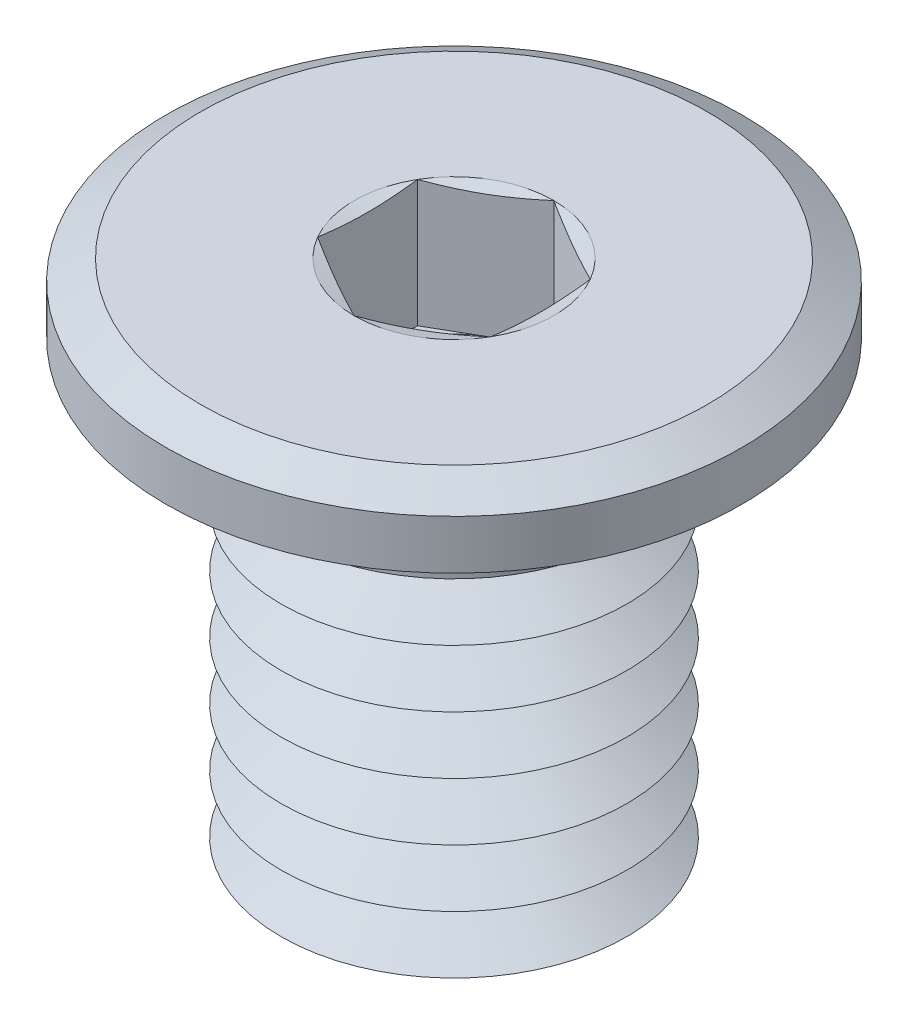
SolidWorks part; units mm, degrees
ref_plane "Front Plane" through (0, 0, 0) normal (0, 0, 1) x (1, 0, 0)
ref_plane "Top Plane" through (0, 0, 0) normal (0, 1, 0) x (1, 0, 0)
ref_plane "Right Plane" through (0, 0, 0) normal (1, 0, 0) x (0, 0, -1)
sketch "Sketch1" plane through (0, 0, 0) normal (0, 1, 0) x (1, 0, 0)
  circle A0 centre (0, 0) radius 5
  dimension "D1" = 10
extrude "Boss-Extrude1" add sketch "Sketch1" against normal blind 1.2
sketch "Sketch2" plane through (0, -1.2, 0) normal (0, -1, 0) x (1, 0, 0)
  circle A0 centre (0, 0) radius 3
  dimension "D1" = 6
extrude "Boss-Extrude2" add sketch "Sketch2" along normal blind 8
sketch "Sketch3" plane through (0, 0, 0) normal (1, 0, 0) x (0, 0, -1)
  line L0 (0, 0.9906) -> (0, -8.2999) construction
sketch "Sketch5" plane through (0, 0, 0) normal (1, 0, 0) x (0, 0, -1)
  line L0 (-3, -9.7) -> (-2.134, -9.2)
  line L1 (-3, -1.2) -> (-3, -9.2) construction
  line L2 (-2.134, -9.2) -> (-3, -8.7)
  line L3 (-3, -1.2) -> (-3, -9.2) construction
  line L4 (-3, -8.7) -> (-3, -9.7)
  line L6 (-3, -1.2) -> (-3, -9.2) construction
  line L7 (-3, -1.2) -> (-3, -9.2) construction
  line L14 (-3, -9.2) -> (3, -9.2) construction
  dimension "D1" = 1
revolve "Cut-Revolve1" cut sketch "Sketch5" angle 360 about L0
pattern_linear "LPattern1" count 7 spacing 1 along (0, 1, 0) of "Cut-Revolve1"
fillet "Fillet1" radius 0.25 1 edges at (0, -1.2, -3)
chamfer "Chamfer2" distance 0.6 angle 30 1 edges at (0, 0, 5)
sketch "Sketch6" plane through (0, 0, 0) normal (0, 1, 0) x (1, 0, 0)
  line L1 (0, 1.7321) -> (-1.5, 0.866)
  line L2 (-1.5, 0.866) -> (-1.5, -0.866)
  line L3 (-1.5, -0.866) -> (0, -1.7321)
  line L4 (0, -1.7321) -> (1.5, -0.866)
  line L5 (1.5, -0.866) -> (1.5, 0.866)
  line L6 (1.5, 0.866) -> (0, 1.7321)
  circle A0 centre (0, 0) radius 1.5 construction
  dimension "D1" = 3
extrude "Cut-Extrude1" cut sketch "Sketch6" against normal blind 2.2
sketch "Sketch7" plane through (0, -2.2, 0) normal (0, 1, 0) x (1, 0, 0)
  line L0 (-1.5, 0.866) -> (-1.5, -0.866) construction
  circle A0 centre (0, 0) radius 1.5
extrude "Cut-Extrude2" cut sketch "Sketch7" against normal through all draft 60
sketch "Sketch8" plane through (0, 0, 0) normal (0, 1, 0) x (1, 0, 0)
  circle A0 centre (0, 0) radius 1.7321
extrude "Cut-Extrude3" cut sketch "Sketch8" against normal through all draft 75
